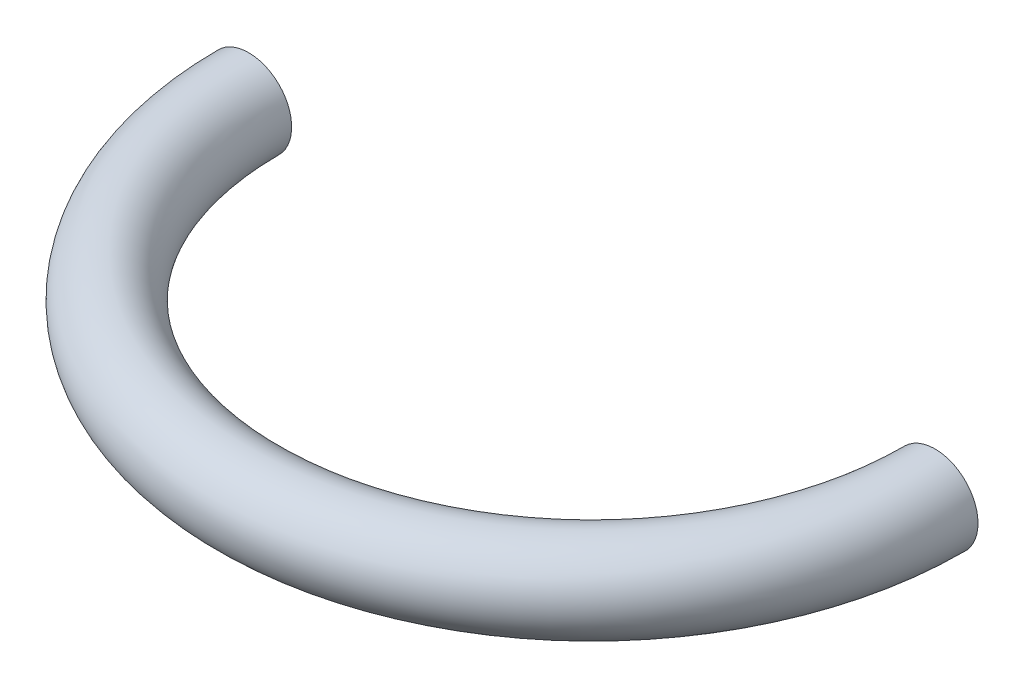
SolidWorks part; units mm, degrees
ref_plane "Ebene vorne" through (0, 0, 0) normal (0, 0, 1) x (1, 0, 0)
ref_plane "Ebene oben" through (0, 0, 0) normal (0, 1, 0) x (1, 0, 0)
ref_plane "Ebene rechts" through (0, 0, 0) normal (1, 0, 0) x (0, 0, -1)
sketch "Skizze1" plane through (0, 0, 0) normal (0, 0, 1) x (1, 0, 0)
  line L0 (0, 0) -> (0, 22.1979) construction
  circle A0 centre (-20, 0) radius 2.5
  dimension "D1" = 5
  dimension "D2" = 40
revolve "Rotation1" add sketch "Skizze1" angle 180 about L0
